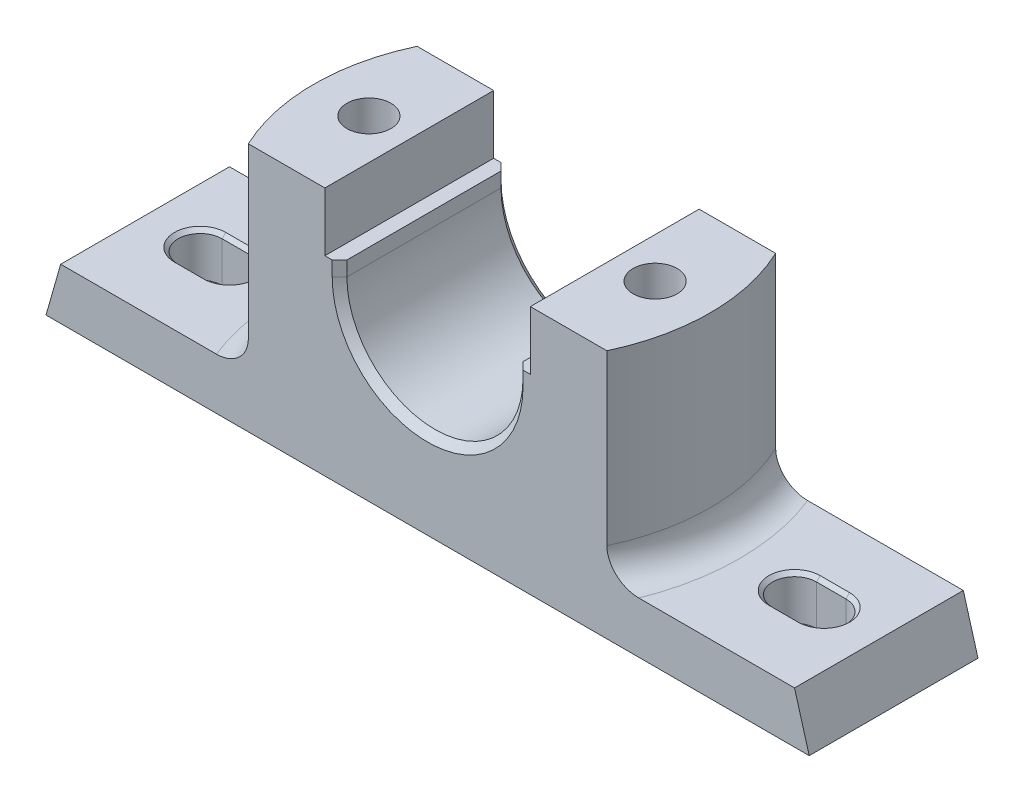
SolidWorks part; units mm, degrees
ref_plane "Front" through (0, 0, 0) normal (0, 0, 1) x (1, 0, 0)
ref_plane "Top" through (0, 0, 0) normal (0, 1, 0) x (1, 0, 0)
ref_plane "Right" through (0, 0, 0) normal (1, 0, 0) x (0, 0, -1)
sketch "Sketch1" plane through (0, 0, 0) normal (0, 0, 1) x (1, 0, 0)
  line L0 (-104, 0) -> (104, 0)
  line L1 (0, 91.4502) -> (0, -4.8887) construction
  line L2 (104, 0) -> (100, 14)
  line L3 (-104, 0) -> (-100, 14)
  line L4 (100, 14) -> (54, 14)
  line L5 (-100, 14) -> (-54, 14)
  line L6 (54, 14) -> (54, 68)
  line L7 (-54, 14) -> (-54, 68)
  line L8 (54, 68) -> (28, 68)
  line L9 (-54, 68) -> (-28, 68)
  line L10 (28, 68) -> (28, 52)
  line L11 (-28, 68) -> (-28, 52)
  line L12 (28, 52) -> (24, 52)
  line L13 (-28, 52) -> (-24, 52)
  line L14 (24, 52) -> (24, 48)
  line L15 (-24, 52) -> (-24, 48)
  arc A0 (24, 48) -> (0, 24) centre (0, 48) cw
  arc A1 (-24, 48) -> (0, 24) centre (0, 48) ccw
  dimension "D7" = 48
  dimension "D1" = 208
  dimension "D2" = 4
  dimension "D3" = 14
  dimension "D4" = 56
  dimension "D5" = 16
  dimension "D6" = 4
  dimension "D8" = 68
  dimension "D9" = 54
extrude "Extrude1" add sketch "Sketch1" along normal mid plane 46
sketch "Sketch3" plane through (0, 68, 0) normal (0, 1, 0) x (-1, 0, 0)
  line L0 (28, -23) -> (54, -23) construction
  line L1 (28, 23) -> (54, 23) construction
  line L2 (54, 23) -> (54, -23) construction
  line L3 (0, 0) -> (0, 34.4965) construction
  line L4 (0, 23) -> (0, -23) construction
  line L5 (-48.8569, 23) -> (48.8569, 23)
  line L6 (-48.8569, -23) -> (48.8569, -23)
  arc A0 (48.8569, -23) -> (48.8569, 23) centre (0, 0) ccw
  arc A1 (-48.8569, -23) -> (-48.8569, 23) centre (0, 0) cw
extrude "Cut-Extrude1" cut sketch "Sketch3" against normal up to surface (54 mm away) flip side to cut
sketch "Sketch6" plane through (0, 0, 0) normal (0, -1, 0) x (1, 0, 0)
  line L0 (-97.5, -17.5) -> (97.5, 17.5) construction
  line L1 (-97.5, 17.5) -> (97.5, 17.5)
  line L2 (-97.5, 17.5) -> (-97.5, -17.5)
  line L3 (-97.5, -17.5) -> (97.5, -17.5)
  line L4 (97.5, 17.5) -> (97.5, -17.5)
  dimension "D1" = 195
  dimension "D2" = 35
extrude "Cut-Extrude5" cut sketch "Sketch6" against normal blind 2
sketch "Sketch4" plane through (0, 2, 0) normal (0, -1, 0) x (1, 0, 0)
  line L0 (0, 31.712) -> (0, -36.3528) construction
  line L2 (0, 23) -> (0, -23) construction
  line L3 (52, -13) -> (26, 13) construction
  line L4 (26, 13) -> (52, 13)
  line L5 (26, 13) -> (26, -13)
  line L6 (26, -13) -> (52, -13)
  line L7 (52, 13) -> (52, -13)
  line L8 (-52, 13) -> (-52, -13)
  line L9 (-26, -13) -> (-52, -13)
  line L10 (-26, 13) -> (-26, -13)
  line L11 (-26, 13) -> (-52, 13)
  circle A0 centre (39, 0) radius 6
  circle A1 centre (-39, 0) radius 6
  dimension "D3" = 12
  dimension "D1" = 78
  dimension "D2" = 26
extrude "Cut-Extrude2" cut sketch "Sketch4" against normal blind 10 contours L4 L7 L6 L5 | L11 L8 L9 L10
other "Hole1"
sketch "Sketch7" plane through (0, 12, 0) normal (0, -1, 0) x (1, 0, 0)
  line L0 (-26, -13) -> (-52, 13) construction
  circle A0 centre (-39, 0) radius 6
  dimension "D1" = 12
other "Hole2"
sketch "Sketch8" plane through (0, 12, 0) normal (0, -1, 0) x (1, 0, 0)
  line L0 (52, -13) -> (26, 13) construction
  circle A0 centre (39, 0) radius 6
  dimension "D1" = 12
sketch "Sketch5"
  line L0 (0, 36.3528) -> (0, -48.1095) construction
  line L1 (0, 23) -> (0, -23) construction
  line L2 (77, 6) -> (85, -6) construction
  line L3 (77, 6) -> (85, 6)
  line L4 (-77, -6) -> (-85, -6)
  line L5 (77, -6) -> (85, -6)
  line L6 (-77, 6) -> (-85, 6)
  arc A0 (77, 6) -> (77, -6) centre (77, 0) ccw
  arc A1 (85, -6) -> (85, 6) centre (85, 0) ccw
  arc A2 (-85, -6) -> (-85, 6) centre (-85, 0) cw
  arc A3 (-77, 6) -> (-77, -6) centre (-77, 0) cw
  point P10 (81, 0)
  point P17 (-81, 0)
chamfer "Chamfer1" distance 2 angle 45
fillet "Fillet1" radius 8
extrude "Cut-Extrude4" cut sketch "Sketch5" against normal through all
chamfer "Chamfer2" distance 1 angle 45
